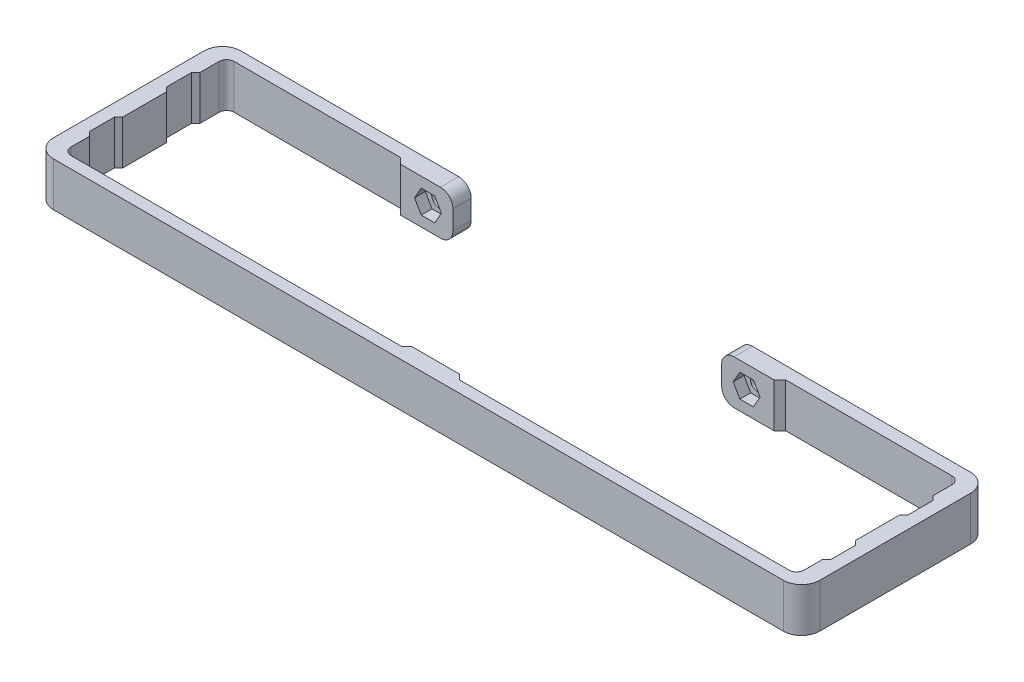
SolidWorks part; units mm, degrees
ref_plane "Front Plane" through (0, 0, 0) normal (0, 0, 1) x (1, 0, 0)
ref_plane "Top Plane" through (0, 0, 0) normal (0, 1, 0) x (1, 0, 0)
ref_plane "Right Plane" through (0, 0, 0) normal (1, 0, 0) x (0, 0, -1)
sketch "Sketch1" plane through (0, 0, 0) normal (0, 0, 1) x (1, 0, 0)
  line L1 (-62.8026, 47.8166) -> (121.3974, 47.8166)
  line L2 (-62.8026, 47.8166) -> (-62.8026, 37.2166)
  line L3 (-62.8026, 37.2166) -> (121.3974, 37.2166)
  line L4 (121.3974, 47.8166) -> (121.3974, 37.2166)
  dimension "D1" = 184.2
  dimension "D2" = 10.6
extrude "Boss-Extrude1" add sketch "Sketch1" along normal blind 4
ref_plane "Plane1" through (0, 0, 0) normal (0, 0, -1) x (-1, 0, 0)
sketch "Sketch2" plane through (0, 0, 0) normal (0, 0, -1) x (-1, 0, 0)
  line L0 (-121.3974, 47.8166) -> (62.8026, 47.8166) construction
  line L1 (-121.3974, 37.2166) -> (-117.3974, 37.2166)
  line L2 (-121.3974, 37.2166) -> (-121.3974, 47.8166)
  line L3 (-121.3974, 47.8166) -> (-117.3974, 47.8166)
  line L4 (-117.3974, 37.2166) -> (-117.3974, 47.8166)
  line L6 (62.8026, 37.2166) -> (58.8026, 37.2166)
  line L7 (62.8026, 37.2166) -> (62.8026, 47.8166)
  line L8 (62.8026, 47.8166) -> (58.8026, 47.8166)
  line L9 (58.8026, 37.2166) -> (58.8026, 47.8166)
  dimension "D1" = 4
  dimension "D2" = 4
extrude "Boss-Extrude2" add sketch "Sketch2" along normal blind 41
ref_plane "Plane2" through (0, 47.8166, 0) normal (0, 1, 0) x (1, 0, 0)
sketch "Sketch3" plane through (0, 47.8166, 0) normal (0, 1, 0) x (1, 0, 0)
  line L1 (-58.8026, 41) -> (-3.0026, 41)
  line L2 (-58.8026, 41) -> (-58.8026, 36.6)
  line L3 (-58.8026, 36.6) -> (-3.0026, 36.6)
  line L4 (-3.0026, 41) -> (-3.0026, 36.6)
  line L5 (117.3974, 41) -> (61.5974, 41)
  line L6 (117.3974, 41) -> (117.3974, 36.6)
  line L7 (117.3974, 36.6) -> (61.5974, 36.6)
  line L8 (61.5974, 41) -> (61.5974, 36.6)
  dimension "D1" = 4.4
  dimension "D2" = 4.4
  dimension "D3" = 55.8
  dimension "D4" = 55.8
extrude "Boss-Extrude3" add sketch "Sketch3" against normal blind 10.6
fillet "Fillet1" radius 4.4 4 edges at (121.3974, 42.5166, -41) (-62.8026, 42.5166, -41) (-62.8026, 42.5166, 4) (121.3974, 42.5166, 4)
ref_plane "Plane3" through (0, 0, -41) normal (0, 0, -1) x (-1, 0, 0)
sketch "Sketch4" plane through (0, 0, -41) normal (0, 0, -1) x (-1, 0, 0)
  line L0 (3.0026, 37.2166) -> (3.0026, 47.8166) construction
  line L1 (58.4026, 47.8166) -> (3.0026, 47.8166) construction
  line L2 (-61.5974, 47.8166) -> (-116.9974, 47.8166) construction
  line L3 (-61.5974, 37.2166) -> (-61.5974, 47.8166) construction
  circle A0 centre (9.0026, 42.5166) radius 1.7
  circle A1 centre (-67.5974, 42.5166) radius 1.7
  dimension "D1" = 3.4
  dimension "D2" = 3.4
  dimension "D3" = 6
  dimension "D4" = 5.3
  dimension "D5" = 5.3
  dimension "D6" = 6
extrude "Cut-Extrude1" cut sketch "Sketch4" against normal blind 10.6
ref_plane "Plane4" through (0, 0, -36.6) normal (0, 0, 1) x (1, 0, 0)
sketch "Sketch5" plane through (0, 0, -36.6) normal (0, 0, 1) x (1, 0, 0)
  line L1 (-7.386, 39.7166) -> (-5.7695, 42.5166)
  line L2 (-5.7695, 42.5166) -> (-7.386, 45.3166)
  line L3 (-7.386, 45.3166) -> (-10.6192, 45.3166)
  line L4 (-10.6192, 45.3166) -> (-12.2358, 42.5166)
  line L5 (-12.2358, 42.5166) -> (-10.6192, 39.7166)
  line L6 (-10.6192, 39.7166) -> (-7.386, 39.7166)
  line L7 (69.214, 39.7166) -> (70.8305, 42.5166)
  line L8 (70.8305, 42.5166) -> (69.214, 45.3166)
  line L9 (69.214, 45.3166) -> (65.9808, 45.3166)
  line L10 (65.9808, 45.3166) -> (64.3642, 42.5166)
  line L11 (64.3642, 42.5166) -> (65.9808, 39.7166)
  line L12 (65.9808, 39.7166) -> (69.214, 39.7166)
  circle A0 centre (-9.0026, 42.5166) radius 2.8 construction
  circle A1 centre (67.5974, 42.5166) radius 2.8 construction
  dimension "D1" = 5.6
  dimension "D2" = 5.6
extrude "Cut-Extrude2" cut sketch "Sketch5" against normal blind 2.6
sketch "Sketch6" plane through (0, 47.8166, 0) normal (0, 1, 0) x (1, 0, 0)
  line L0 (121.3974, 0.4) -> (121.3974, 36.6) construction
  line L1 (117.3974, 4) -> (118.3974, 4)
  line L2 (117.3974, 4) -> (117.3974, 14)
  line L3 (117.3974, 14) -> (118.3974, 14)
  line L4 (118.3974, 4) -> (118.3974, 14)
  line L5 (117.3974, 32.6) -> (118.3974, 32.6)
  line L6 (117.3974, 32.6) -> (117.3974, 22.6)
  line L7 (117.3974, 22.6) -> (118.3974, 22.6)
  line L8 (118.3974, 32.6) -> (118.3974, 22.6)
  line L9 (117.3974, 36.6) -> (117.3974, 0) construction
  line L10 (-58.8026, 4) -> (-59.8026, 4)
  line L11 (-58.8026, 4) -> (-58.8026, 14)
  line L12 (-58.8026, 14) -> (-59.8026, 14)
  line L13 (-59.8026, 4) -> (-59.8026, 14)
  line L14 (-58.8026, 32.6) -> (-59.8026, 32.6)
  line L15 (-58.8026, 32.6) -> (-58.8026, 22.6)
  line L16 (-58.8026, 22.6) -> (-59.8026, 22.6)
  line L17 (-59.8026, 32.6) -> (-59.8026, 22.6)
  line L18 (-58.8026, 36.6) -> (-58.8026, 0) construction
  line L19 (117.3974, 0) -> (-58.8026, 0) construction
  line L20 (61.5974, 36.6) -> (117.3974, 36.6) construction
  line L21 (-62.8026, 0.4) -> (-62.8026, 36.6) construction
  line L22 (-58.8026, 36.6) -> (-3.0026, 36.6) construction
  point P32 (117.8974, 4)
  dimension "D1" = 3
  dimension "D2" = 3
  dimension "D3" = 4
  dimension "D4" = 10
  dimension "D5" = 4
  dimension "D6" = 10
  dimension "D7" = 4
  dimension "D8" = 3
  dimension "D9" = 3
  dimension "D10" = 4
  dimension "D11" = 10
  dimension "D12" = 10
extrude "Cut-Extrude3" cut sketch "Sketch6" against normal blind 13.6
sketch "Sketch7" plane through (0, 47.8166, 0) normal (0, 1, 0) x (1, 0, 0)
  line L0 (116.9974, -4) -> (-58.4026, -4) construction
  line L1 (117.3974, 0) -> (34.3974, 0)
  line L2 (117.3974, 0) -> (117.3974, -1.2)
  line L3 (117.3974, -1.2) -> (34.3974, -1.2)
  line L4 (34.3974, 0) -> (34.3974, -1.2)
  line L5 (-58.8026, 0) -> (24.3974, 0)
  line L6 (-58.8026, 0) -> (-58.8026, -1.2)
  line L7 (-58.8026, -1.2) -> (24.3974, -1.2)
  line L8 (24.3974, 0) -> (24.3974, -1.2)
  line L9 (-58.4026, 41) -> (-3.0026, 41) construction
  line L10 (117.3974, 36.6) -> (73.5974, 36.6)
  line L11 (117.3974, 36.6) -> (117.3974, 38)
  line L12 (117.3974, 38) -> (73.5974, 38)
  line L13 (73.5974, 36.6) -> (73.5974, 38)
  line L14 (-58.8026, 36.6) -> (-15.0026, 36.6)
  line L15 (-58.8026, 36.6) -> (-58.8026, 38)
  line L16 (-58.8026, 38) -> (-15.0026, 38)
  line L17 (-15.0026, 36.6) -> (-15.0026, 38)
  line L18 (61.5974, 41) -> (116.9974, 41) construction
  line L19 (61.5974, 41) -> (61.5974, 36.6) construction
  line L20 (-3.0026, 36.6) -> (-3.0026, 41) construction
  point P26 (73.5974, 37.3)
  point P31 (-3.0026, 38.8)
  dimension "D1" = 10
  dimension "D2" = 83
  dimension "D3" = 2.8
  dimension "D4" = 2.8
  dimension "D5" = 3
  dimension "D6" = 3
  dimension "D7" = 12
  dimension "D8" = 12
extrude "Cut-Extrude4" cut sketch "Sketch7" against normal blind 13.6
chamfer "Chamfer1" distance 2 angle 45 12 edges at (73.5974, 42.5166, -38) (-15.0026, 42.5166, -38) (118.3974, 42.5166, -32.6) (118.3974, 42.5166, -4) (118.3974, 42.5166, -14) (118.3974, 42.5166, -22.6) (34.3974, 42.5166, 1.2) (24.3974, 42.5166, 1.2) (-59.8026, 42.5166, -14) (-59.8026, 42.5166, -4) (-59.8026, 42.5166, -22.6) (-59.8026, 42.5166, -32.6)
fillet "Fillet2" radius 1.8 4 edges at (117.3974, 42.5166, -38) (117.3974, 42.5166, 1.2) (-58.8026, 42.5166, -38) (-58.8026, 42.5166, 1.2)
fillet "Fillet3" radius 3 4 edges at (-3.0026, 47.8166, -38.8) (-3.0026, 37.2166, -38.8) (61.5974, 47.8166, -38.8) (61.5974, 37.2166, -38.8)
